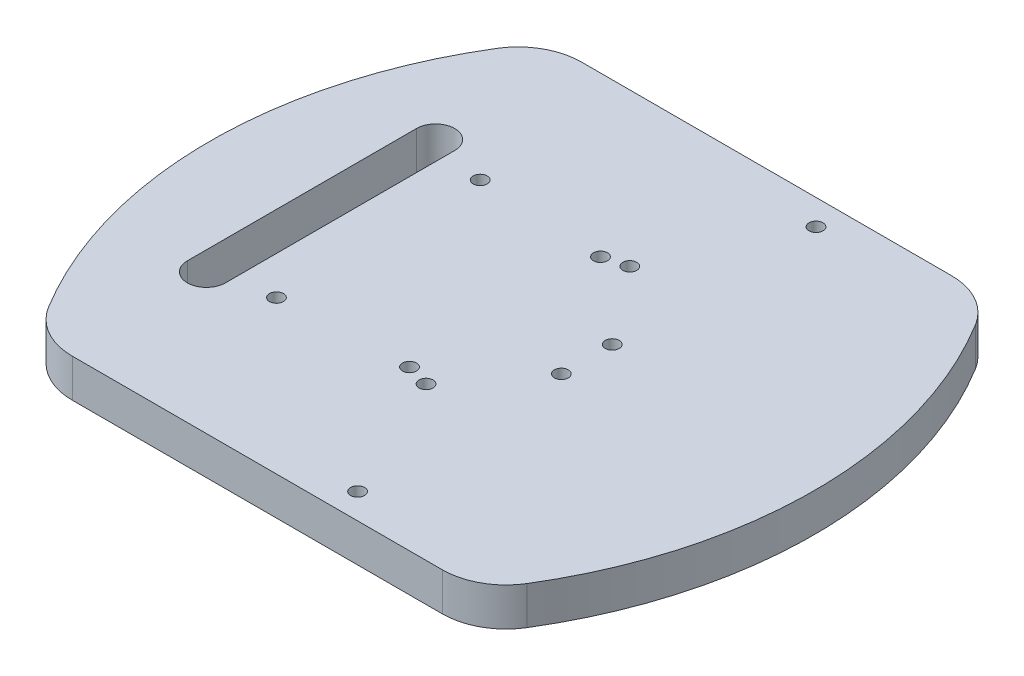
SolidWorks part; units mm, degrees
ref_plane "Plan de face" through (0, 0, 0) normal (0, 0, 1) x (1, 0, 0)
ref_plane "Plan de dessus" through (0, 0, 0) normal (0, 1, 0) x (1, 0, 0)
ref_plane "Plan de droite" through (0, 0, 0) normal (1, 0, 0) x (0, 0, -1)
sketch "Esquisse1" plane through (0, 0, 0) normal (0, 1, 0) x (1, 0, 0)
  line L0 (-111.0793, 0) -> (144.6389, 0) construction
  line L1 (0, -103.2463) -> (0, 92.4278) construction
  line L2 (-35, 40) -> (78.1596, 40) construction
  line L3 (5.6, 47) -> (5.6, 29.4615) construction
  line L4 (6.75, 42.1123) -> (6.75, 8.5) construction
  line L5 (36.9653, 36) -> (2.8283, 36) construction
  line L6 (34.3052, 20) -> (65, 20) construction
  line L7 (29, 54.1791) -> (29, -44.9752) construction
  line L8 (-34.0535, 40) -> (24.0535, 40)
  line L9 (-34.0535, -40) -> (24.0535, -40)
  line L10 (-39.7987, 16) -> (58.2616, 16) construction
  line L11 (-46.2908, 32) -> (36.9653, 32) construction
  line L12 (-38, 44.6634) -> (-38, -34.2446) construction
  line L13 (-9.5, 9.9383) -> (-9.5, -28.5023) construction
  line L14 (-2.5, 9.9383) -> (-2.5, 22.7519) construction
  line L15 (-26, 9.9383) -> (-26, 22.7519) construction
  line L16 (-35, 25.2191) -> (-35, -14.3295) construction
  line L17 (-64.3052, -63) -> (-26, -63) construction
  line L18 (26, -63) -> (34.3052, -63) construction
  line L19 (-26, -63) -> (-26, -47) construction
  line L20 (26, -63) -> (26, -47) construction
  line L21 (-22, -43) -> (22, -43) construction
  line L22 (26, 63) -> (34.3052, 63) construction
  line L23 (26, 63) -> (26, 47) construction
  line L24 (-22, 43) -> (22, 43) construction
  line L25 (-26, 63) -> (-26, 47) construction
  line L26 (-64.3052, 63) -> (-26, 63) construction
  line L27 (-38, 18) -> (-38, -18)
  line L28 (-32, 18) -> (-32, -18)
  line L29 (19, 36.0508) -> (19, -36) construction
  line L30 (22.8, 26.8888) -> (22.8, -60.7912) construction
  line L31 (28.9411, 24.2) -> (-65.8756, 24.2) construction
  line L32 (-65.8756, -24.2) -> (28.9411, -24.2) construction
  line L33 (-6.1, 18.8782) -> (-6.1, -60.7912) construction
  arc A0 (34.3052, -63) -> (34.3052, 63) centre (-15, 0) ccw construction
  arc A1 (-42.5846, -35.2174) -> (-34.0535, -40) centre (-34.0535, -30) ccw
  arc A2 (-42.5846, -35.2174) -> (-42.5846, 35.2174) centre (15, 0) cw
  arc A3 (-34.0535, 40) -> (-42.5846, 35.2174) centre (-34.0535, 30) ccw
  circle A4 centre (-2.5, 16) radius 1.1
  circle A5 centre (-26, 16) radius 1.1
  circle A6 centre (-2.5, -16) radius 1.1
  circle A7 centre (-26, -16) radius 1.1
  circle A8 centre (-6.1, 15) radius 1.1
  arc A9 (26, 47) -> (22, 43) centre (22, 47) cw construction
  arc A10 (-64.3052, 63) -> (-64.3052, -63) centre (-15, 0) ccw construction
  arc A11 (-22, 43) -> (-26, 47) centre (-22, 47) cw construction
  arc A12 (22, -43) -> (26, -47) centre (22, -47) cw construction
  arc A13 (-26, -47) -> (-22, -43) centre (-22, -47) cw construction
  circle A14 centre (-35, -8.5) radius 1.1 construction
  circle A15 centre (-29, 4) radius 2.5 construction
  circle A16 centre (-71, -31.5) radius 1.1 construction
  circle A17 centre (-71, 31.5) radius 1.1 construction
  circle A18 centre (-80, 0) radius 1.1 construction
  circle A19 centre (-35, 8.5) radius 1.1 construction
  circle A20 centre (-35, 0) radius 3.25 construction
  circle A21 centre (-29, -4) radius 2.5 construction
  circle A22 centre (-80, 0) radius 9 construction
  circle A23 centre (6.75, 36) radius 1.1
  circle A24 centre (6.75, 4) radius 1.1
  circle A25 centre (6.75, -36) radius 1.1
  circle A26 centre (6.75, -4) radius 1.1
  arc A28 (-32, -18) -> (-38, -18) centre (-35, -18) cw
  arc A29 (-32, 18) -> (-38, 18) centre (-35, 18) ccw
  circle A30 centre (-6.1, -15) radius 1.1
  arc A31 (32.5846, -35.2174) -> (24.0535, -40) centre (24.0535, -30) cw
  arc A33 (32.5846, -35.2174) -> (32.5846, 35.2174) centre (-25, 0) ccw
  arc A35 (24.0535, 40) -> (32.5846, 35.2174) centre (24.0535, 30) cw
  point P31 (0, -40)
  point P37 (0, 40)
  dimension "D8" = 28.5
  dimension "D9" = 38
  dimension "D13" = 3
  dimension "D16" = 48.4
  dimension "D4" = 22.25
  dimension "D7" = 16
  dimension "D1" = 40
  dimension "D2" = 1.15
  dimension "D3" = 20
  dimension "D5" = 57
  dimension "D6" = 32
  dimension "D10" = 7
  dimension "D11" = 23.5
  dimension "D14" = 57.8
  dimension "D15" = 24.2
  dimension "D17" = 28.9
extrude "Extrusion1" add sketch "Esquisse1" along normal blind 6
